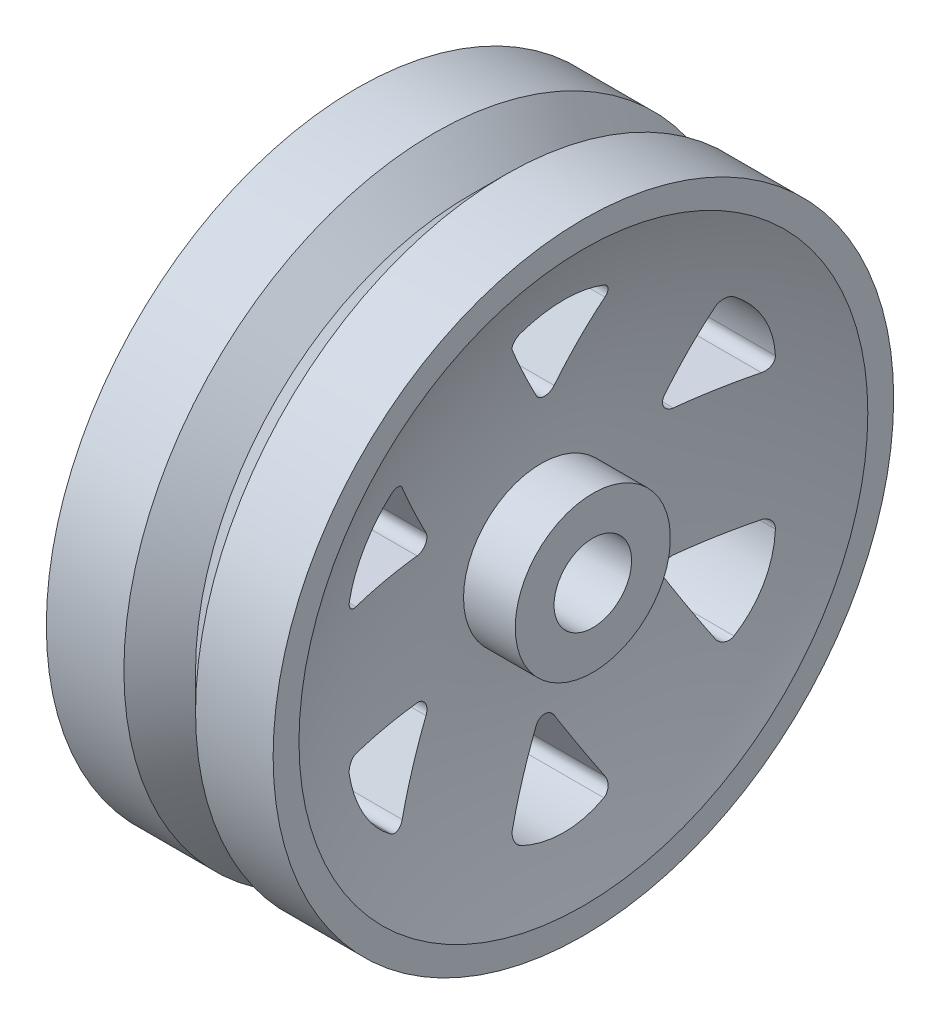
SolidWorks part; units mm, degrees
ref_plane "Front Plane" through (0, 0, 0) normal (0, 0, 1) x (1, 0, 0)
ref_plane "Top Plane" through (0, 0, 0) normal (0, 1, 0) x (1, 0, 0)
ref_plane "Right Plane" through (0, 0, 0) normal (1, 0, 0) x (0, 0, -1)
sketch "Sketch1" plane through (0, 0, 0) normal (0, 0, 1) x (1, 0, 0)
  line L0 (0, 9.525) -> (0, 19.05)
  line L1 (0, 19.05) -> (12.7, 19.05)
  line L2 (2.3134, 69.85) -> (2.3134, 76.2)
  line L3 (2.3134, 76.2) -> (21.3634, 76.2)
  line L4 (21.3634, 76.2) -> (30.1625, 67.4009)
  line L10 (60.325, 9.525) -> (0, 9.525)
  line L11 (0, 0) -> (83.3028, 0) construction
  line L12 (30.1625, 9.525) -> (30.1625, 97.5034) construction
  line L13 (38.9616, 76.2) -> (30.1625, 67.4009)
  line L14 (58.0116, 76.2) -> (38.9616, 76.2)
  line L15 (58.0116, 69.85) -> (58.0116, 76.2)
  line L16 (60.325, 19.05) -> (47.625, 19.05)
  line L17 (60.325, 9.525) -> (60.325, 19.05)
  arc A0 (12.7, 19.05) -> (2.3134, 69.85) centre (-116.7222, 19.05) ccw
  arc A2 (47.625, 19.05) -> (58.0116, 69.85) centre (177.0472, 19.05) cw
  dimension "D10" = 129.4222
  dimension "D1" = 30.1625
  dimension "D2" = 9.525
  dimension "D3" = 76.2
  dimension "D4" = 9.525
  dimension "D5" = 45
  dimension "D6" = 12.7
  dimension "D7" = 6.35
  dimension "D9" = 19.05
revolve "Revolve1" add sketch "Sketch1" angle 360 about L11
sketch "Sketch2" plane through (58.0116, 0, 0) normal (1, 0, 0) x (0, 0, -1)
  line L0 (2.1997, 35.0659) -> (11.3592, 50.9307)
  line L1 (-11.3592, 50.9307) -> (-2.1997, 35.0659)
  line L2 (31.4678, 15.628) -> (49.7869, 15.628)
  line L3 (38.4276, 35.3027) -> (29.2681, 19.438)
  line L4 (29.2681, -19.438) -> (38.4276, -35.3027)
  line L5 (49.7869, -15.628) -> (31.4678, -15.628)
  line L6 (-2.1997, -35.0659) -> (-11.3592, -50.9307)
  line L7 (11.3592, -50.9307) -> (2.1997, -35.0659)
  line L8 (-31.4678, -15.628) -> (-49.7869, -15.628)
  line L9 (-38.4276, -35.3027) -> (-29.2681, -19.438)
  line L10 (-29.2681, 19.438) -> (-38.4276, 35.3027)
  line L11 (-49.7869, 15.628) -> (-31.4678, 15.628)
  arc A0 (10.1772, 54.5279) -> (-10.1772, 54.5279) centre (0, 31.2559) ccw
  arc A1 (11.3592, 50.9307) -> (10.1772, 54.5279) centre (9.1595, 52.2007) ccw
  arc A2 (-10.1772, 54.5279) -> (-11.3592, 50.9307) centre (-9.1595, 52.2007) ccw
  arc A3 (2.1997, 35.0659) -> (-2.1997, 35.0659) centre (0, 36.3359) cw
  arc A4 (49.7869, 15.628) -> (52.3111, 18.4502) centre (49.7869, 18.168) ccw
  arc A5 (52.3111, 18.4502) -> (42.1339, 36.0777) centre (27.0684, 15.628) ccw
  arc A6 (42.1339, 36.0777) -> (38.4276, 35.3027) centre (40.6273, 34.0327) ccw
  arc A7 (31.4678, 15.628) -> (29.2681, 19.438) centre (31.4678, 18.168) cw
  arc A8 (38.4276, -35.3027) -> (42.1339, -36.0777) centre (40.6273, -34.0327) ccw
  arc A9 (42.1339, -36.0777) -> (52.3111, -18.4502) centre (27.0684, -15.628) ccw
  arc A10 (52.3111, -18.4502) -> (49.7869, -15.628) centre (49.7869, -18.168) ccw
  arc A11 (29.2681, -19.438) -> (31.4678, -15.628) centre (31.4678, -18.168) cw
  arc A12 (-11.3592, -50.9307) -> (-10.1772, -54.5279) centre (-9.1595, -52.2007) ccw
  arc A13 (-10.1772, -54.5279) -> (10.1772, -54.5279) centre (0, -31.2559) ccw
  arc A14 (10.1772, -54.5279) -> (11.3592, -50.9307) centre (9.1595, -52.2007) ccw
  arc A15 (-2.1997, -35.0659) -> (2.1997, -35.0659) centre (0, -36.3359) cw
  arc A16 (-49.7869, -15.628) -> (-52.3111, -18.4502) centre (-49.7869, -18.168) ccw
  arc A17 (-52.3111, -18.4502) -> (-42.1339, -36.0777) centre (-27.0684, -15.628) ccw
  arc A18 (-42.1339, -36.0777) -> (-38.4276, -35.3027) centre (-40.6273, -34.0327) ccw
  arc A19 (-31.4678, -15.628) -> (-29.2681, -19.438) centre (-31.4678, -18.168) cw
  arc A20 (-38.4276, 35.3027) -> (-42.1339, 36.0777) centre (-40.6273, 34.0327) ccw
  arc A21 (-42.1339, 36.0777) -> (-52.3111, 18.4502) centre (-27.0684, 15.628) ccw
  arc A22 (-52.3111, 18.4502) -> (-49.7869, 15.628) centre (-49.7869, 18.168) ccw
  arc A23 (-29.2681, 19.438) -> (-31.4678, 15.628) centre (-31.4678, 18.168) cw
  point P4 (0, 56.6559)
  point P8 (12.7, 53.253)
  point P13 (0, 31.2559)
  point P66 (0, 0)
  dimension "D2" = 2.54
  dimension "D1" = 25.4
  dimension "D3" = 60
  dimension "D4" = 6
extrude "Cut-Extrude1" cut sketch "Sketch2" against normal through all
ref_plane "Plane1" through (30.1625, 0, 0) normal (1, 0, 0) x (0, 0, -1)
